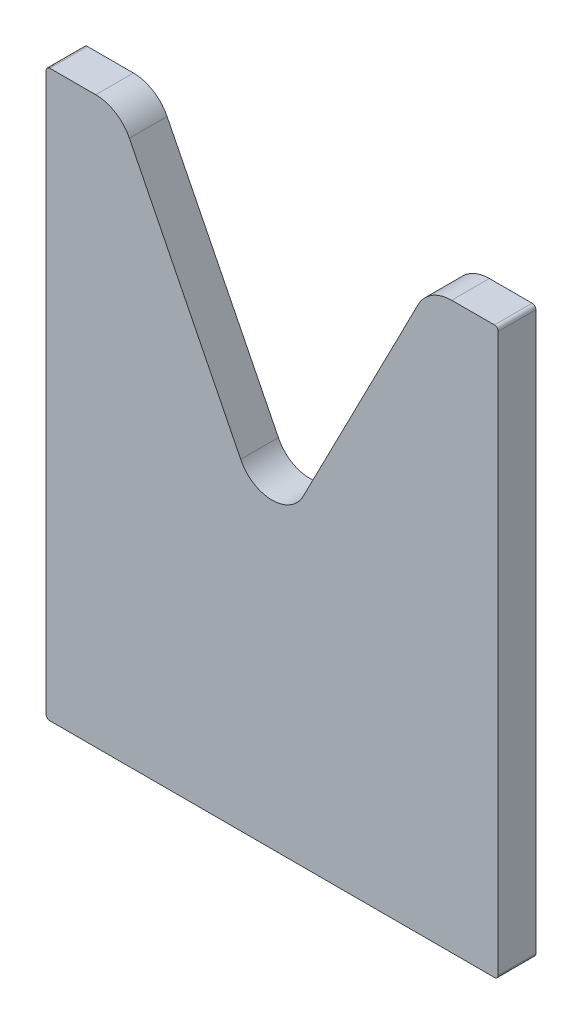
SolidWorks part; units mm, degrees
ref_plane "Piano frontale" through (0, 0, 0) normal (0, 0, 1) x (1, 0, 0)
ref_plane "Piano superiore" through (0, 0, 0) normal (0, 1, 0) x (1, 0, 0)
ref_plane "Piano destro" through (0, 0, 0) normal (1, 0, 0) x (0, 0, -1)
sketch "Schizzo1" plane through (0, 0, 0) normal (0, 0, 1) x (1, 0, 0)
  line L0 (-59, 75) -> (-46.83, 75)
  line L2 (-60, 74) -> (-60, -74)
  line L3 (-59, -75) -> (59, -75)
  line L4 (60, 74) -> (60, -74)
  line L5 (-60, 75) -> (60, -75) construction
  line L6 (-60, -75) -> (60, 75) construction
  line L7 (59, 75) -> (47.65, 75)
  line L8 (0, -75) -> (0, 14.5) construction
  line L9 (-37.8869, 69.4745) -> (-8.3468, 10.4335)
  line L10 (8.3468, 10.4335) -> (38.7568, 69.5729)
  arc A0 (-8.3468, 10.4335) -> (8.3468, 10.4335) centre (0, 14.5) ccw
  arc A1 (47.65, 75) -> (38.7568, 69.5729) centre (47.65, 65) ccw
  arc A2 (-37.8869, 69.4745) -> (-46.83, 75) centre (-46.83, 65) ccw
  arc A3 (59, 75) -> (60, 74) centre (59, 74) cw
  arc A4 (60, -74) -> (59, -75) centre (59, -74) cw
  arc A5 (-59, -75) -> (-60, -74) centre (-59, -74) cw
  arc A6 (-60, 74) -> (-59, 75) centre (-59, 74) cw
  point P0 (0, 0)
  dimension "D3" = 10
  dimension "D9" = 1
  dimension "D1" = 120
  dimension "D2" = 150
  dimension "D4" = 13.17
  dimension "D5" = 12.35
  dimension "D6" = 89.5
  dimension "D7" = 66.5
  dimension "D8" = 66.0187
base flange "Base-Flangia1" sketch "Schizzo1" thickness 10 reverse thickness direction no parameters "D1"=1.5
sketch "Linee di piegatura1" [suppressed] plane through (0, 0, 0) normal (0, 1, 0) x (1, 0, 0)
sketch "Casella di contorno1" [suppressed] plane through (0, 0, 0) normal (0, 1, 0) x (1, 0, 0)
sheet metal parameters "Lamiera1" thickness 10 parameters "D1"=1.5
flat pattern "Ripetizione piatta1"
sketch "Linee di piegatura2" plane through (0, 0, 0) normal (0, 1, 0) x (1, 0, 0)
sketch3d "Casella di contorno2" [suppressed]
  line L0 (60, 60.5, 0) -> (60, -89.5, 0) construction
  line L1 (-60, 60.5, 0) -> (-60, -89.5, 0) construction
  line L2 (60, 60.5, 0) -> (-60, 60.5, 0) construction
  line L3 (60, -89.5, 0) -> (-60, -89.5, 0) construction
